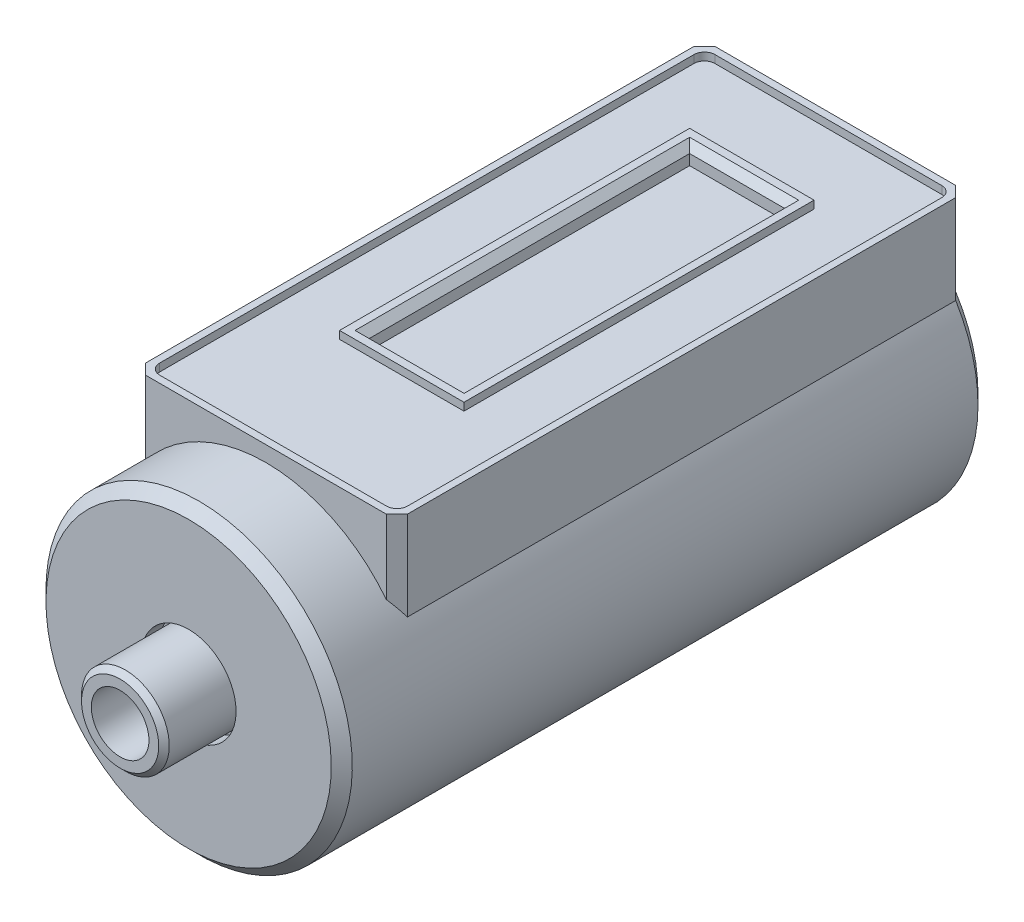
SolidWorks part; units mm, degrees
ref_plane "Front" through (0, 0, 0) normal (0, 0, 1) x (1, 0, 0)
ref_plane "Top" through (0, 0, 0) normal (0, 1, 0) x (1, 0, 0)
ref_plane "Right" through (0, 0, 0) normal (1, 0, 0) x (0, 0, -1)
sketch "Sketch2" plane through (0, 0, 0) normal (1, 0, 0) x (0, 0, -1)
  line L0 (59.435, 0) -> (59.435, 2.79)
  line L1 (59.815, 3.17) -> (65.655, 3.17)
  line L2 (64.385, 3.43) -> (64.385, 10.31)
  line L3 (65.145, 11.07) -> (111.125, 11.07)
  line L4 (111.125, 11.07) -> (111.125, 0)
  line L5 (111.125, 0) -> (59.435, 0)
  line L6 (64.385, 3.43) -> (65.655, 3.43)
  line L7 (65.655, 3.43) -> (65.655, 3.17)
  line L8 (59.435, 2.79) -> (59.815, 3.17)
  line L9 (64.385, 10.31) -> (65.145, 11.07)
  dimension "D1" = 51.69
  dimension "D2" = 3.17
  dimension "D3" = 11.07
  dimension "D4" = 4.95
  dimension "D5" = 1.27
  dimension "D6" = 3.43
  dimension "D7" = 2.79
  dimension "D8" = 0.38
  dimension "D9" = 0.76
  dimension "D10" = 10.31
  dimension "D11" = 111.125
revolve "Revolve1" add sketch "Sketch2" angle 360 about L5
sketch "Sketch3" plane through (0, 0, 0) normal (0, 1, 0) x (1, 0, 0)
  line L0 (11.07, 111.125) -> (-11.07, 111.125) construction
  line L1 (-9.46, 111.125) -> (9.46, 111.125)
  line L2 (-9.46, 111.125) -> (-9.46, 70.735)
  line L3 (-8.7, 69.975) -> (8.7, 69.975)
  line L4 (9.46, 111.125) -> (9.46, 70.735)
  line L5 (-9.46, 70.735) -> (-8.7, 69.975)
  line L6 (9.46, 70.735) -> (8.7, 69.975)
  point P1 (9.46, 69.975)
  point P2 (-9.46, 69.975)
  point P6 (0, 69.975)
  dimension "D1" = 41.15
  dimension "D2" = 18.92
extrude "Extrude1" add sketch "Sketch3" along normal blind 12.19
chamfer "Chamfer1" distance 0.76 angle 45 3 edges at (-9.46, 8.9696, -111.125) (0, -11.07, -111.125) (9.46, 8.9696, -111.125)
sketch "Sketch4" plane through (0, 12.19, 0) normal (0, 1, 0) x (1, 0, 0)
  line L0 (-8.7, 69.975) -> (8.7, 69.975) construction
  line L1 (-8.19, 110.615) -> (8.2, 110.615)
  line L2 (-8.95, 109.855) -> (-8.95, 71.245)
  line L3 (-8.19, 70.485) -> (8.2, 70.485)
  line L4 (8.96, 109.855) -> (8.96, 71.245)
  line L5 (-9.46, 70.735) -> (-9.46, 110.365) construction
  line L7 (-4.49, 105.085) -> (4.5, 105.085)
  line L8 (-4.49, 105.085) -> (-4.49, 79.785)
  line L9 (-4.49, 79.785) -> (4.5, 79.785)
  line L10 (4.5, 105.085) -> (4.5, 79.785)
  arc A0 (-8.95, 109.855) -> (-8.19, 110.615) centre (-8.19, 109.855) cw
  arc A1 (8.96, 109.855) -> (8.2, 110.615) centre (8.2, 109.855) ccw
  arc A2 (8.96, 71.245) -> (8.2, 70.485) centre (8.2, 71.245) cw
  arc A3 (-8.95, 71.245) -> (-8.19, 70.485) centre (-8.19, 71.245) ccw
  dimension "D5" = 0.76
  dimension "D1" = 17.91
  dimension "D2" = 40.13
  dimension "D3" = 0.51
  dimension "D4" = 0.51
  dimension "D6" = 5.53
  dimension "D7" = 4.46
  dimension "D8" = 4.46
  dimension "D9" = 25.3
extrude "Cut-Extrude1" cut sketch "Sketch4" against normal blind 0.56
sketch "Sketch5" plane through (0, 12.19, 0) normal (0, 1, 0) x (1, 0, 0)
  line L1 (-3.42, 104.015) -> (3.44, 104.015)
  line L2 (-3.42, 104.015) -> (-3.42, 80.855)
  line L3 (-3.42, 80.855) -> (3.44, 80.855)
  line L4 (3.44, 104.015) -> (3.44, 80.855)
  line L6 (4.5, 105.085) -> (-4.49, 105.085) construction
  line L7 (-4.49, 105.085) -> (-4.49, 79.785) construction
  point P4 (0.005, 105.085)
  dimension "D1" = 6.86
  dimension "D2" = 23.16
  dimension "D3" = 1.07
  dimension "D4" = 1.07
extrude "Cut-Extrude2" cut sketch "Sketch5" against normal blind 1.27
chamfer "Chamfer2" distance 0.51 angle 45 4 edges at (0.01, 12.19, -80.855) (3.44, 12.19, -92.435) (-3.42, 12.19, -92.435) (0.01, 12.19, -104.015)
hole_wizard "Hole1" positions "Sketch7" profile "Sketch6" legacy
sketch "Sketch7" plane through (0, 0, -59.435) normal (0, 0, 1) x (1, 0, 0)
  circle A0 centre (0, 0) radius 3.17 construction
  point P0 (0, 0)
sketch "Sketch6" plane through (0, 0, -59.435) normal (1, 0, 0) x (0, -1, 0)
  line L0 (0, 0) -> (0, 7.6015)
  line L1 (0, 7.6015) -> (2.0828, 6.35)
  line L2 (2.0828, 6.35) -> (2.0828, 0)
  line L4 (2.0828, 0) -> (0, 0)
  line L6 (0, 7.6015) -> (-2.0828, 6.35) construction
  line L7 (0, -4.2442) -> (0, 117.3081) construction
  dimension "Diameter" = 4.1656
  dimension "Depth" = 6.35
  dimension "Drill Angle" = 118
